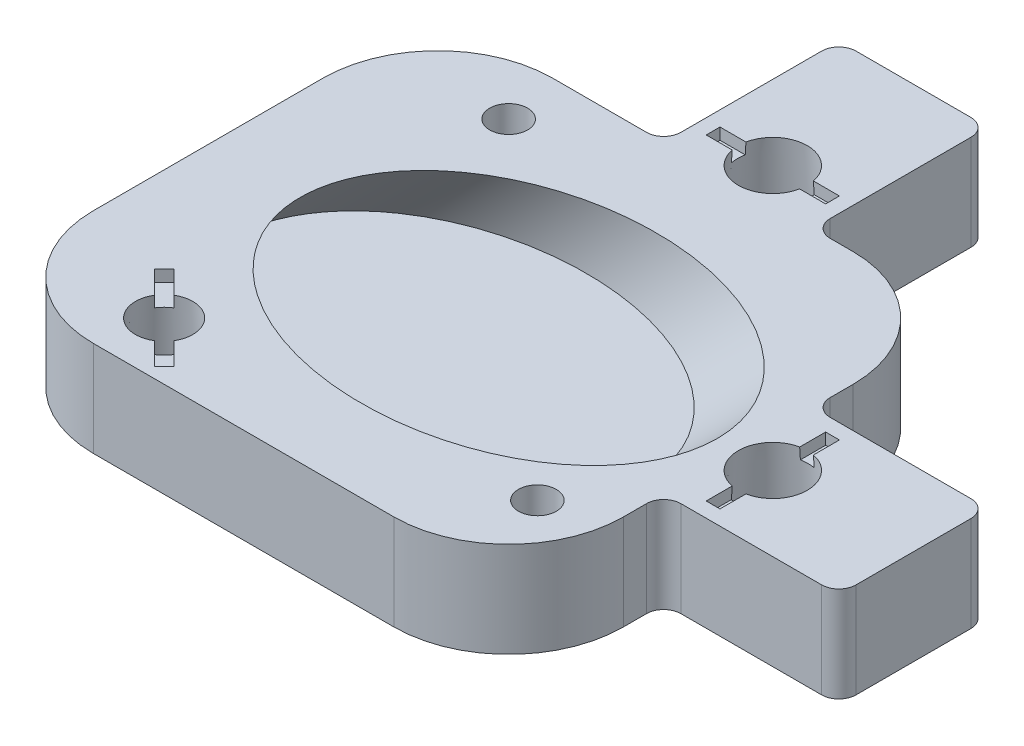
SolidWorks part; units mm, degrees
ref_plane "Front Plane" through (0, 0, 0) normal (0, 0, 1) x (1, 0, 0)
ref_plane "Top Plane" through (0, 0, 0) normal (0, 1, 0) x (1, 0, 0)
ref_plane "Right Plane" through (0, 0, 0) normal (1, 0, 0) x (0, 0, -1)
sketch "Sketch2" plane through (0, 0, 0) normal (0, 1, 0) x (1, 0, 0)
  line L1 (20, -20) -> (20, -6.5)
  line L2 (20, -6.5) -> (35.25, -6.5)
  line L3 (35.25, -6.5) -> (35.25, 6.5)
  line L4 (35.25, 6.5) -> (20, 6.5)
  line L5 (20, 6.5) -> (20, 20)
  line L6 (20, 20) -> (6.5, 20)
  line L7 (6.5, 20) -> (6.5, 35.25)
  line L8 (6.5, 35.25) -> (-6.5, 35.25)
  line L9 (-6.5, 35.25) -> (-6.5, 20)
  line L10 (-6.5, 20) -> (-26.17, 20)
  line L11 (-26.17, 20) -> (-26.17, -20)
  line L16 (0, 0) -> (0, 35.25) construction
  line L17 (0, 0) -> (35.25, 0) construction
  line L20 (0, 0) -> (-26.17, 0) construction
  line L21 (0, 0) -> (0, -20) construction
  line L22 (0, 23) -> (0, 0) construction
  line L23 (0, 0) -> (23, 0) construction
  line L24 (-15, -15) -> (0, -15) construction
  line L25 (-15, -15) -> (-15, 0) construction
  line L28 (-26.17, -20) -> (20, -20)
  line L32 (0, 0) -> (-15, -15) construction
  circle A2 centre (23, 0) radius 3
  circle A3 centre (0, 23) radius 3
  circle A4 centre (-15, -15) radius 2.5
  circle A5 centre (-15, 15) radius 1.65
  circle A6 centre (15, -12.5) radius 1.65
  ellipse E0 centre (0, 0) end of major axis (-18.17, 0) minor radius 12.85 construction
  point P12 (0, 35.25)
  point P17 (35.25, 0)
  point P49 (0, 0)
  dimension "D3" = 35.25
  dimension "D7" = 6
  dimension "D11" = 5
  dimension "D9" = 12.85
  dimension "D13" = 18.17
  dimension "D5" = 3.3
  dimension "D1" = 20
  dimension "D2" = 23
  dimension "D4" = 13
  dimension "D6" = 12.5
  dimension "D8" = 20
  dimension "D10" = 15
  dimension "D15" = 8
  dimension "D17" = 15
  dimension "D18" = 15
  dimension "D20" = 15
extrude "Boss-Extrude1" add sketch "Sketch2" along normal blind 8.3
ref_plane "Plane3" through (0, 2.2, 0) normal (0, -1, 0) x (-1, 0, 0)
sketch "Sketch17" plane through (0, 8.3, 0) normal (0, 1, 0) x (1, 0, 0)
  line L0 (18.17, 20) -> (18.17, -20) construction
  line L1 (20, 20) -> (6.5, 20) construction
  line L3 (-26.17, -20) -> (20, -20) construction
  dimension "D1" = 18.17
ref_plane "Plane4" through (13.235, 13.235, 0) normal (0.7071, 0.7071, 0) x (0, 0, 1)
sketch "Sketch19" plane through (13.235, 13.235, 0) normal (0.7071, 0.7071, 0) x (0, 0, 1)
  line L1 (6.5, 19.0565) -> (-6.5, 19.0565) construction
  line L2 (-35.25, -1.2728) -> (-35.25, -10.4652) construction
  circle A0 centre (0, -5.869) radius 12.85
  point P8 (0, 19.0565)
  point P10 (-35.25, -5.869)
  dimension "D1" = 25.7
extrude "Cut-Extrude4" cut sketch "Sketch19" against normal up to surface (34.3248 mm away)
fillet "Fillet1" radius 1.5 8 edges at (-6.5, 4.15, -20) (-6.5, 4.15, -35.25) (6.5, 4.15, -35.25) (6.5, 4.15, -20) (20, 4.15, -6.5) (35.25, 4.15, -6.5) (35.25, 4.15, 6.5) (20, 4.15, 6.5)
fillet "Fillet2" radius 10 4 edges at (-26.17, 4.15, -20) (20, 4.15, -20) (20, 4.15, 20) (-26.17, 4.15, 20)
ref_plane "Plane2" through (0, 0, 0) normal (0, 0, 1) x (1, 0, 0)
sketch "Sketch15" plane through (0, 0, 0) normal (0, 0, 1) x (1, 0, 0)
  line L0 (0, 0) -> (0, -1.5) construction
  line L1 (0, 0) -> (0, 1.2)
  line L3 (2.245, 0) -> (0, 0)
  line L4 (-16.17, 0) -> (10, 0) construction
  arc A0 (0, 1.2) -> (2.245, 0) centre (0, -1.5) cw
  dimension "D2" = 2.7
  dimension "D1" = 1.5
revolve "Cut-Revolve1" cut sketch "Sketch15" angle 360 about L1
sketch "Sketch14" plane through (0, 8.3, 0) normal (0, 1, 0) x (1, 0, 0)
  line L0 (22.4, 5.2) -> (23.6, 5.2)
  line L1 (23.6, 5.2) -> (23.6, -5.2)
  line L2 (23.6, -5.2) -> (22.4, -5.2)
  line L3 (22.4, -5.2) -> (22.4, 5.2)
  line L4 (-5.2, 23.6) -> (5.2, 23.6)
  line L5 (5.2, 23.6) -> (5.2, 22.4)
  line L6 (5.2, 22.4) -> (-5.2, 22.4)
  line L7 (-5.2, 22.4) -> (-5.2, 23.6)
  line L8 (-18.2527, -10.8988) -> (-10.8988, -18.2527)
  line L9 (-10.8988, -18.2527) -> (-11.7473, -19.1012)
  line L10 (-11.7473, -19.1012) -> (-19.1012, -11.7473)
  line L11 (-19.1012, -11.7473) -> (-18.2527, -10.8988)
  line L12 (-15, -15) -> (-15.4243, -15.4243) construction
  line L13 (-15, -15) -> (-14.5757, -14.5757) construction
  line L14 (-15, -15) -> (-18.677, -11.323) construction
  line L15 (-15, -15) -> (-11.323, -18.677) construction
  line L16 (-26.17, 10) -> (-26.17, -10) construction
  point P0 (23, 0)
  point P1 (0, 23)
  point P2 (-15, -15)
  point P5 (23, 5.2)
  point P11 (23, -5.2)
  point P12 (23.6, 0)
  point P13 (22.4, 0)
  point P18 (0, 23.6)
  point P19 (0, 22.4)
  point P20 (5.2, 23)
  point P21 (-5.2, 23)
  dimension "D3" = 10.4
  dimension "D4" = 1.2
  dimension "D7" = 135
extrude "Cut-Extrude2" cut sketch "Sketch14" against normal blind 1
sketch "Sketch16" plane through (0, 0, 0) normal (0, -1, 0) x (1, 0, 0)
  line L1 (-13.2391, -11.95) -> (-16.7609, -11.95)
  line L2 (-16.7609, -11.95) -> (-18.5218, -15)
  line L3 (-18.5218, -15) -> (-16.7609, -18.05)
  line L4 (-16.7609, -18.05) -> (-13.2391, -18.05)
  line L5 (-13.2391, -18.05) -> (-11.4782, -15)
  line L6 (-11.4782, -15) -> (-13.2391, -11.95)
  line L15 (18.05, 14.2609) -> (15, 16.0218)
  line L16 (15, 16.0218) -> (11.95, 14.2609)
  line L17 (11.95, 14.2609) -> (11.95, 10.7391)
  line L18 (11.95, 10.7391) -> (15, 8.9782)
  line L19 (15, 8.9782) -> (18.05, 10.7391)
  line L20 (18.05, 10.7391) -> (18.05, 14.2609)
  line L22 (-8, -20) -> (-16.17, -20) construction
  line L23 (20, 10) -> (20, 8) construction
  circle A0 centre (-15, -15) radius 3.05 construction
  circle A1 centre (15, 12.5) radius 3.05 construction
  dimension "D1" = 6.1
extrude "Cut-Extrude3" cut sketch "Sketch16" against normal blind 3.9
chamfer "Chamfer1" distance 8.3 distance2 0.5 3 edges at (0, 0, -20) (23, 0, 3) (-15, 0, 17.5)
sketch "Sketch20" plane through (0, 0, 0) normal (0, -1, 0) x (1, 0, 0)
  line L0 (27.25, 0.6) -> (34.25, 0.6)
  line L1 (34.25, 0.6) -> (34.25, -0.6)
  line L2 (34.25, -0.6) -> (27.25, -0.6)
  line L3 (27.25, -0.6) -> (27.25, 0.6)
  line L4 (-0.6, -27.25) -> (0.6, -27.25)
  line L5 (0.6, -27.25) -> (0.6, -34.25)
  line L6 (0.6, -34.25) -> (-0.6, -34.25)
  line L7 (-0.6, -34.25) -> (-0.6, -27.25)
  line L8 (35.25, 5) -> (35.25, -5) construction
  line L9 (34.25, 0) -> (35.25, 0) construction
  line L10 (0, -34.25) -> (0, -35.25) construction
  line L11 (5, -35.25) -> (-5, -35.25) construction
  point P5 (27.25, 0)
  point P14 (0, -27.25)
  dimension "D1" = 1.2
  dimension "D2" = 7
  dimension "D3" = 1
extrude "Cut-Extrude5" cut sketch "Sketch20" against normal blind 0.4
fillet "Fillet3" radius 0.2 8 edges at (30.75, 0.4, -0.6) (30.75, 0.4, 0.6) (-0.6, 0.4, -30.75) (0.6, 0.4, -30.75) (-0.6, 0, -30.75) (0.6, 0, -30.75) (30.75, 0, -0.6) (30.75, 0, 0.6)
